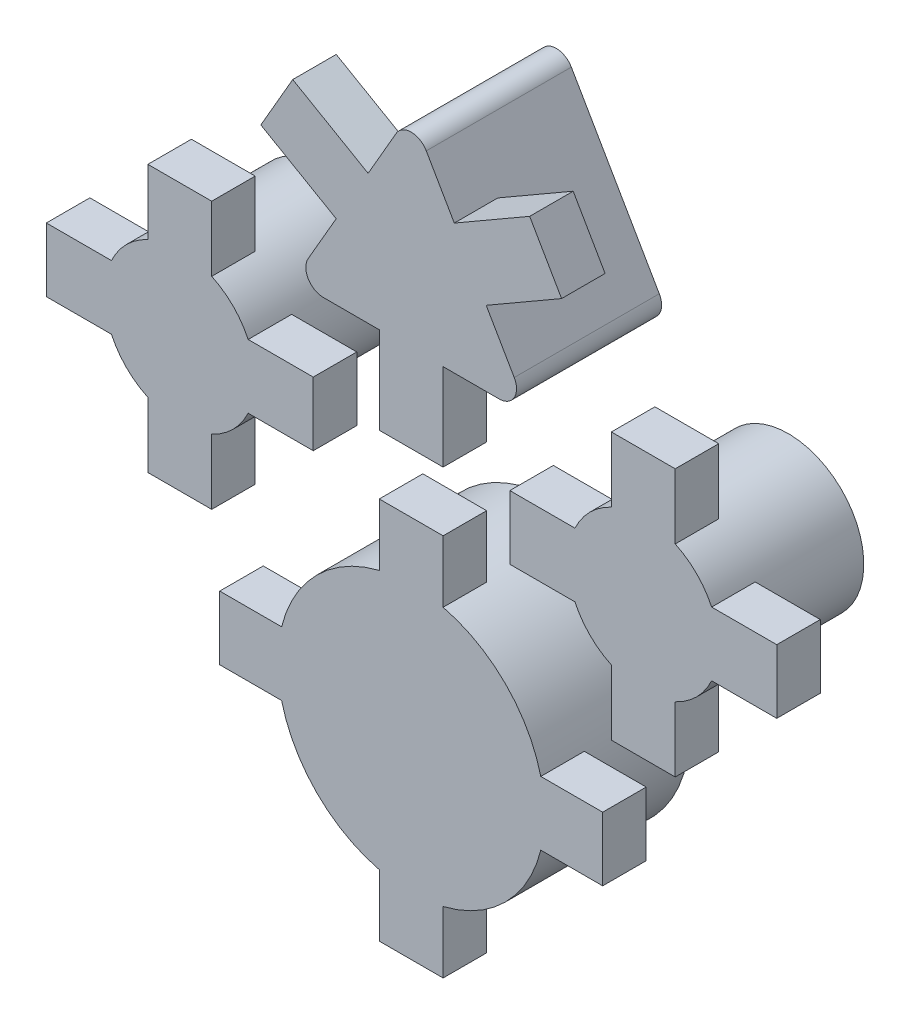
SolidWorks part; units mm, degrees
ref_plane "Front Plane" through (0, 0, 0) normal (0, 0, 1) x (1, 0, 0)
ref_plane "Top Plane" through (0, 0, 0) normal (0, 1, 0) x (1, 0, 0)
ref_plane "Right Plane" through (0, 0, 0) normal (1, 0, 0) x (0, 0, -1)
sketch "Sketch1" plane through (0, 0, 0) normal (0, 0, 1) x (1, 0, 0)
  line L25 (-42.627, -37.592) -> (-39.7769, -37.592)
  line L26 (-42.627, -34.798) -> (-42.627, -37.592)
  line L27 (-39.7769, -34.798) -> (-42.627, -34.798)
  line L28 (-38.182, -30.353) -> (-38.182, -33.2031)
  line L29 (-35.388, -30.353) -> (-38.182, -30.353)
  line L30 (-35.388, -33.2031) -> (-35.388, -30.353)
  line L31 (-30.943, -34.798) -> (-33.7931, -34.798)
  line L32 (-30.943, -37.592) -> (-30.943, -34.798)
  line L33 (-33.7931, -37.592) -> (-30.943, -37.592)
  line L34 (-35.388, -42.037) -> (-35.388, -39.1869)
  line L35 (-38.182, -42.037) -> (-35.388, -42.037)
  line L36 (-38.182, -39.1869) -> (-38.182, -42.037)
  line L37 (-42.627, -37.592) -> (-39.7769, -37.592)
  line L38 (-42.627, -34.798) -> (-42.627, -37.592)
  line L39 (-39.7769, -34.798) -> (-42.627, -34.798)
  line L40 (-38.182, -30.353) -> (-38.182, -33.2031)
  line L41 (-35.388, -30.353) -> (-38.182, -30.353)
  line L42 (-35.388, -33.2031) -> (-35.388, -30.353)
  line L43 (-30.943, -34.798) -> (-33.7931, -34.798)
  line L44 (-30.943, -37.592) -> (-30.943, -34.798)
  line L45 (-33.7931, -37.592) -> (-30.943, -37.592)
  line L46 (-35.388, -42.037) -> (-35.388, -39.1869)
  line L47 (-38.182, -42.037) -> (-35.388, -42.037)
  line L48 (-38.182, -39.1869) -> (-38.182, -42.037)
  line L62 (-22.337, -37.592) -> (-19.4869, -37.592)
  line L63 (-22.337, -34.798) -> (-22.337, -37.592)
  line L64 (-19.4869, -34.798) -> (-22.337, -34.798)
  line L65 (-17.892, -30.353) -> (-17.892, -33.2031)
  line L66 (-15.098, -30.353) -> (-17.892, -30.353)
  line L67 (-15.098, -33.2031) -> (-15.098, -30.353)
  line L68 (-10.653, -34.798) -> (-13.5031, -34.798)
  line L69 (-10.653, -37.592) -> (-10.653, -34.798)
  line L70 (-13.5031, -37.592) -> (-10.653, -37.592)
  line L71 (-15.098, -42.037) -> (-15.098, -39.1869)
  line L72 (-17.892, -42.037) -> (-15.098, -42.037)
  line L73 (-17.892, -39.1869) -> (-17.892, -42.037)
  line L74 (-22.337, -37.592) -> (-19.4869, -37.592)
  line L75 (-22.337, -34.798) -> (-22.337, -37.592)
  line L76 (-19.4869, -34.798) -> (-22.337, -34.798)
  line L77 (-17.892, -30.353) -> (-17.892, -33.2031)
  line L78 (-15.098, -30.353) -> (-17.892, -30.353)
  line L79 (-15.098, -33.2031) -> (-15.098, -30.353)
  line L80 (-10.653, -34.798) -> (-13.5031, -34.798)
  line L81 (-10.653, -37.592) -> (-10.653, -34.798)
  line L82 (-13.5031, -37.592) -> (-10.653, -37.592)
  line L83 (-15.098, -42.037) -> (-15.098, -39.1869)
  line L84 (-17.892, -42.037) -> (-15.098, -42.037)
  line L85 (-17.892, -39.1869) -> (-17.892, -42.037)
  line L98 (-28.052, -37.973) -> (-28.052, -40.6825)
  line L99 (-25.258, -37.973) -> (-28.052, -37.973)
  line L100 (-25.258, -40.6825) -> (-25.258, -37.973)
  line L101 (-18.273, -44.958) -> (-20.9825, -44.958)
  line L102 (-18.273, -47.752) -> (-18.273, -44.958)
  line L103 (-20.9825, -47.752) -> (-18.273, -47.752)
  line L104 (-25.258, -54.737) -> (-25.258, -52.0275)
  line L105 (-28.052, -54.737) -> (-25.258, -54.737)
  line L106 (-28.052, -52.0275) -> (-28.052, -54.737)
  line L107 (-35.037, -47.752) -> (-32.3275, -47.752)
  line L108 (-35.037, -44.958) -> (-35.037, -47.752)
  line L109 (-32.3275, -44.958) -> (-35.037, -44.958)
  line L110 (-28.052, -37.973) -> (-28.052, -40.6825)
  line L111 (-25.258, -37.973) -> (-28.052, -37.973)
  line L112 (-25.258, -40.6825) -> (-25.258, -37.973)
  line L113 (-18.273, -44.958) -> (-20.9825, -44.958)
  line L114 (-18.273, -47.752) -> (-18.273, -44.958)
  line L115 (-20.9825, -47.752) -> (-18.273, -47.752)
  line L116 (-25.258, -54.737) -> (-25.258, -52.0275)
  line L117 (-28.052, -54.737) -> (-25.258, -54.737)
  line L118 (-28.052, -52.0275) -> (-28.052, -54.737)
  line L119 (-35.037, -47.752) -> (-32.3275, -47.752)
  line L120 (-35.037, -44.958) -> (-35.037, -47.752)
  line L121 (-32.3275, -44.958) -> (-35.037, -44.958)
  line L141 (-25.258, -31.5595) -> (-22.8055, -31.5595)
  line L142 (-25.258, -35.3695) -> (-25.258, -31.5595)
  line L143 (-28.052, -35.3695) -> (-25.258, -35.3695)
  line L144 (-28.052, -31.5595) -> (-28.052, -35.3695)
  line L145 (-30.5045, -31.5595) -> (-28.052, -31.5595)
  line L146 (-29.9382, -28.2926) -> (-31.1644, -30.4165)
  line L147 (-33.2377, -26.3876) -> (-29.9382, -28.2926)
  line L148 (-31.8407, -23.9679) -> (-33.2377, -26.3876)
  line L149 (-28.5412, -25.8729) -> (-31.8407, -23.9679)
  line L150 (-27.3149, -23.749) -> (-28.5412, -25.8729)
  line L151 (-24.7688, -25.8729) -> (-25.9951, -23.749)
  line L152 (-21.4693, -23.9679) -> (-24.7688, -25.8729)
  line L153 (-20.0723, -26.3876) -> (-21.4693, -23.9679)
  line L154 (-23.3718, -28.2926) -> (-20.0723, -26.3876)
  line L155 (-22.1456, -30.4165) -> (-23.3718, -28.2926)
  line L156 (-25.258, -31.5595) -> (-22.8055, -31.5595)
  line L157 (-25.258, -35.3695) -> (-25.258, -31.5595)
  line L158 (-28.052, -35.3695) -> (-25.258, -35.3695)
  line L159 (-28.052, -31.5595) -> (-28.052, -35.3695)
  line L160 (-30.5045, -31.5595) -> (-28.052, -31.5595)
  line L161 (-29.9382, -28.2926) -> (-31.1644, -30.4165)
  line L162 (-33.2377, -26.3876) -> (-29.9382, -28.2926)
  line L163 (-31.8407, -23.9679) -> (-33.2377, -26.3876)
  line L164 (-28.5412, -25.8729) -> (-31.8407, -23.9679)
  line L165 (-27.3149, -23.749) -> (-28.5412, -25.8729)
  line L166 (-24.7688, -25.8729) -> (-25.9951, -23.749)
  line L167 (-21.4693, -23.9679) -> (-24.7688, -25.8729)
  line L168 (-20.0723, -26.3876) -> (-21.4693, -23.9679)
  line L169 (-23.3718, -28.2926) -> (-20.0723, -26.3876)
  line L170 (-22.1456, -30.4165) -> (-23.3718, -28.2926)
  arc A8 (-39.7769, -37.592) -> (-38.182, -39.1869) centre (-36.785, -36.195) ccw
  arc A9 (-38.182, -33.2031) -> (-39.7769, -34.798) centre (-36.785, -36.195) ccw
  arc A10 (-33.7931, -34.798) -> (-35.388, -33.2031) centre (-36.785, -36.195) ccw
  arc A11 (-35.388, -39.1869) -> (-33.7931, -37.592) centre (-36.785, -36.195) ccw
  arc A12 (-39.7769, -37.592) -> (-38.182, -39.1869) centre (-36.785, -36.195) ccw
  arc A13 (-38.182, -33.2031) -> (-39.7769, -34.798) centre (-36.785, -36.195) ccw
  arc A14 (-33.7931, -34.798) -> (-35.388, -33.2031) centre (-36.785, -36.195) ccw
  arc A15 (-35.388, -39.1869) -> (-33.7931, -37.592) centre (-36.785, -36.195) ccw
  arc A20 (-19.4869, -37.592) -> (-17.892, -39.1869) centre (-16.495, -36.195) ccw
  arc A21 (-17.892, -33.2031) -> (-19.4869, -34.798) centre (-16.495, -36.195) ccw
  arc A22 (-13.5031, -34.798) -> (-15.098, -33.2031) centre (-16.495, -36.195) ccw
  arc A23 (-15.098, -39.1869) -> (-13.5031, -37.592) centre (-16.495, -36.195) ccw
  arc A24 (-19.4869, -37.592) -> (-17.892, -39.1869) centre (-16.495, -36.195) ccw
  arc A25 (-17.892, -33.2031) -> (-19.4869, -34.798) centre (-16.495, -36.195) ccw
  arc A26 (-13.5031, -34.798) -> (-15.098, -33.2031) centre (-16.495, -36.195) ccw
  arc A27 (-15.098, -39.1869) -> (-13.5031, -37.592) centre (-16.495, -36.195) ccw
  arc A32 (-20.9825, -44.958) -> (-25.258, -40.6825) centre (-26.655, -46.355) ccw
  arc A33 (-25.258, -52.0275) -> (-20.9825, -47.752) centre (-26.655, -46.355) ccw
  arc A34 (-32.3275, -47.752) -> (-28.052, -52.0275) centre (-26.655, -46.355) ccw
  arc A35 (-28.052, -40.6825) -> (-32.3275, -44.958) centre (-26.655, -46.355) ccw
  arc A36 (-20.9825, -44.958) -> (-25.258, -40.6825) centre (-26.655, -46.355) ccw
  arc A37 (-25.258, -52.0275) -> (-20.9825, -47.752) centre (-26.655, -46.355) ccw
  arc A38 (-32.3275, -47.752) -> (-28.052, -52.0275) centre (-26.655, -46.355) ccw
  arc A39 (-28.052, -40.6825) -> (-32.3275, -44.958) centre (-26.655, -46.355) ccw
  arc A42 (-22.8055, -31.5595) -> (-22.1456, -30.4165) centre (-22.8055, -30.7975) ccw
  arc A43 (-31.1644, -30.4165) -> (-30.5045, -31.5595) centre (-30.5045, -30.7975) ccw
  arc A44 (-25.9951, -23.749) -> (-27.3149, -23.749) centre (-26.655, -24.13) ccw
  arc A45 (-22.8055, -31.5595) -> (-22.1456, -30.4165) centre (-22.8055, -30.7975) ccw
  arc A46 (-31.1644, -30.4165) -> (-30.5045, -31.5595) centre (-30.5045, -30.7975) ccw
  arc A47 (-25.9951, -23.749) -> (-27.3149, -23.749) centre (-26.655, -24.13) ccw
  dimension "D1" = 0.508
  dimension "D2" = 0.508
  dimension "D3" = 0.508
  dimension "D4" = 0.508
extrude "Boss-Extrude1" add sketch "Sketch1" against normal up to surface (1.905 mm away)
sketch "Sketch2" plane through (0, 0, -1.905) normal (0, 0, -1) x (-1, 0, 0)
  line L15 (23.3718, -28.2926) -> (22.1456, -30.4165)
  line L16 (20.0723, -26.3876) -> (23.3718, -28.2926)
  line L17 (21.4693, -23.9679) -> (20.0723, -26.3876)
  line L18 (24.7688, -25.8729) -> (21.4693, -23.9679)
  line L19 (25.9951, -23.749) -> (24.7688, -25.8729)
  line L20 (28.5412, -25.8729) -> (27.3149, -23.749)
  line L21 (31.8407, -23.9679) -> (28.5412, -25.8729)
  line L22 (33.2377, -26.3876) -> (31.8407, -23.9679)
  line L23 (29.9382, -28.2926) -> (33.2377, -26.3876)
  line L24 (31.1644, -30.4165) -> (29.9382, -28.2926)
  line L25 (28.052, -31.5595) -> (30.5045, -31.5595)
  line L26 (28.052, -35.3695) -> (28.052, -31.5595)
  line L27 (25.258, -35.3695) -> (28.052, -35.3695)
  line L28 (25.258, -31.5595) -> (25.258, -35.3695)
  line L29 (22.8055, -31.5595) -> (25.258, -31.5595)
  line L30 (23.3718, -28.2926) -> (22.1456, -30.4165)
  line L34 (25.9951, -23.749) -> (23.3718, -28.2926)
  line L35 (28.5412, -25.8729) -> (27.3149, -23.749)
  line L39 (31.1644, -30.4165) -> (28.5412, -25.8729)
  line L40 (28.052, -31.5595) -> (30.5045, -31.5595)
  line L44 (22.8055, -31.5595) -> (28.052, -31.5595)
  circle A0 centre (36.785, -36.195) radius 3.302
  circle A1 centre (26.655, -46.355) radius 5.842
  circle A2 centre (16.495, -36.195) radius 3.302
  arc A6 (22.1456, -30.4165) -> (22.8055, -31.5595) centre (22.8055, -30.7975) ccw
  arc A7 (27.3149, -23.749) -> (25.9951, -23.749) centre (26.655, -24.13) ccw
  arc A8 (30.5045, -31.5595) -> (31.1644, -30.4165) centre (30.5045, -30.7975) ccw
  arc A9 (22.1456, -30.4165) -> (22.8055, -31.5595) centre (22.8055, -30.7975) ccw
  arc A10 (27.3149, -23.749) -> (25.9951, -23.749) centre (26.655, -24.13) ccw
  arc A11 (30.5045, -31.5595) -> (31.1644, -30.4165) centre (30.5045, -30.7975) ccw
  dimension "D1" = 0
extrude "Boss-Extrude2" add sketch "Sketch2" along normal blind 4.445
sketch "Sketch3" [suppressed] plane through (0, 0, -6.35) normal (0, 0, -1) x (-1, 0, 0)
  line L0 (16.8616, -25.1971) -> (23.8052, -35.2622)
  line L1 (23.8052, -35.2622) -> (23.8052, -37.6829)
  line L2 (23.8052, -37.6829) -> (16.1608, -44.9451)
  line L3 (16.1608, -44.9451) -> (24.3973, -56.8841)
  line L4 (24.3973, -56.8841) -> (33.5518, -56.3479)
  line L5 (33.5518, -56.3479) -> (50.3694, -35.2622)
  line L6 (50.3694, -35.2622) -> (39.3839, -23.6985)
  line L7 (39.3839, -23.6985) -> (27.8249, -20.2091)
  line L8 (27.8249, -20.2091) -> (16.8616, -25.1971)
extrude "Cut-Extrude1" [suppressed] cut sketch "Sketch3" against normal through all
sketch "Sketch4" [suppressed] plane through (0, 0, -6.35) normal (0, 0, -1) x (-1, 0, 0)
  line L0 (20.3563, -19.5593) -> (4.7618, -33.5944)
  line L1 (4.7618, -33.5944) -> (14.6598, -44.5922)
  line L2 (14.6598, -44.5922) -> (24.6677, -37.0803)
  line L3 (24.6677, -37.0803) -> (28.0619, -37.0803)
  line L4 (28.0619, -37.0803) -> (38.8863, -46.9874)
  line L5 (38.8863, -46.9874) -> (51.5454, -40.8362)
  line L6 (51.5454, -40.8362) -> (43.1878, -19.5593)
  line L7 (43.1878, -19.5593) -> (20.3563, -19.5593)
extrude "Cut-Extrude2" [suppressed] cut sketch "Sketch4" against normal through all
sketch "Sketch5" [suppressed] plane through (0, 0, -6.35) normal (0, 0, -1) x (-1, 0, 0)
  line L0 (38.2062, -25.446) -> (28.818, -36.0292)
  line L1 (28.818, -36.0292) -> (38.2062, -46.5269)
  line L2 (38.2062, -46.5269) -> (27.9645, -60.5239)
  line L3 (27.9645, -60.5239) -> (8.8466, -57.3661)
  line L4 (8.8466, -57.3661) -> (2.4455, -32.7006)
  line L5 (2.4455, -32.7006) -> (14.3089, -17.9354)
  line L6 (14.3089, -17.9354) -> (38.2062, -25.446)
extrude "Cut-Extrude3" [suppressed] cut sketch "Sketch5" against normal through all
sketch "Sketch6" [suppressed] plane through (0, 0, -6.35) normal (0, 0, -1) x (-1, 0, 0)
  line L0 (14.1223, -24.8786) -> (24.3148, -36.3451)
  line L1 (24.3148, -36.3451) -> (28.4555, -36.3451)
  line L2 (28.4555, -36.3451) -> (38.2658, -24.8786)
  line L3 (38.2658, -24.8786) -> (51.3181, -36.0455)
  line L4 (14.1223, -24.8786) -> (1.5595, -36.0455)
  line L5 (1.5595, -36.0455) -> (13.1031, -55.9657)
  line L6 (13.1031, -55.9657) -> (31.4735, -57.0486)
  line L7 (31.4735, -57.0486) -> (51.3181, -36.0455)
extrude "Cut-Extrude4" [suppressed] cut sketch "Sketch6" against normal through all
